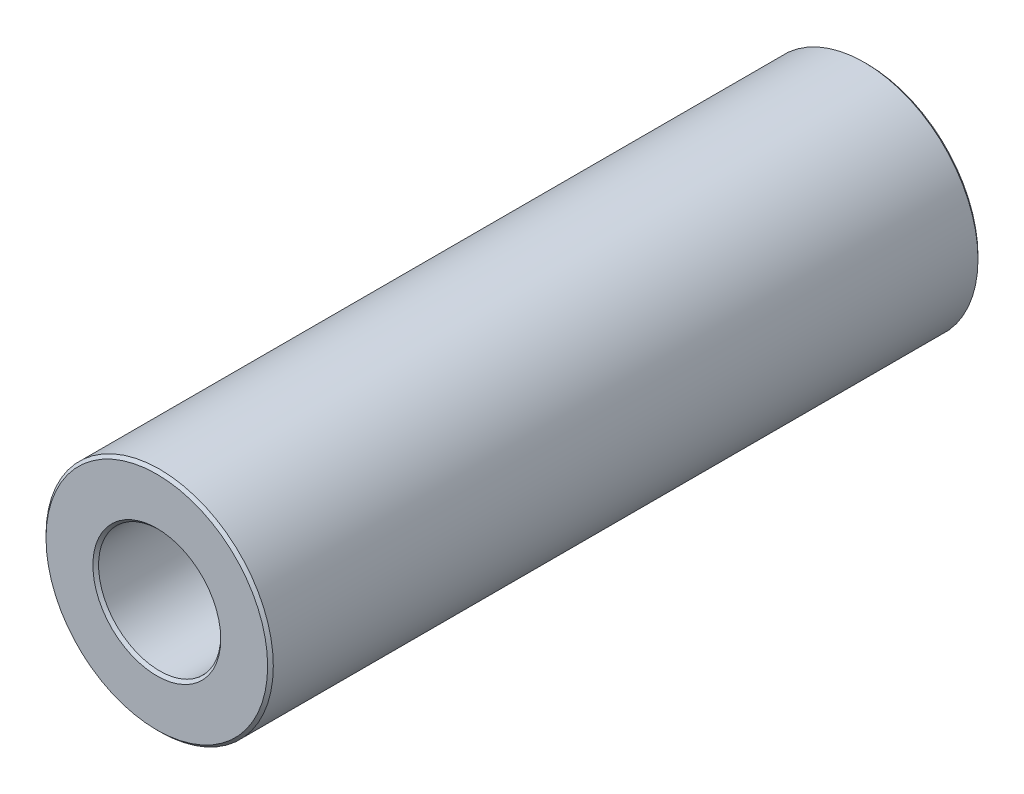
SolidWorks part; units mm, degrees
ref_plane "Front Plane" through (0, 0, 0) normal (0, 0, 1) x (1, 0, 0)
ref_plane "Top Plane" through (0, 0, 0) normal (0, 1, 0) x (1, 0, 0)
ref_plane "Right Plane" through (0, 0, 0) normal (1, 0, 0) x (0, 0, -1)
sketch "Sketch1" plane through (0, 0, 0) normal (0, 0, 1) x (1, 0, 0)
  circle A0 centre (0, 0) radius 4
  circle A1 centre (0, 0) radius 2.15
  dimension "D1" = 8
  dimension "D2" = 4.3
extrude "Boss-Extrude2" add sketch "Sketch1" along normal mid plane 25
chamfer "Chamfer3" distance 0.1 angle 45 4 edges at (4, 0, 12.5) (4, 0, -12.5) (2.15, 0, -12.5) (2.15, 0, 12.5)
